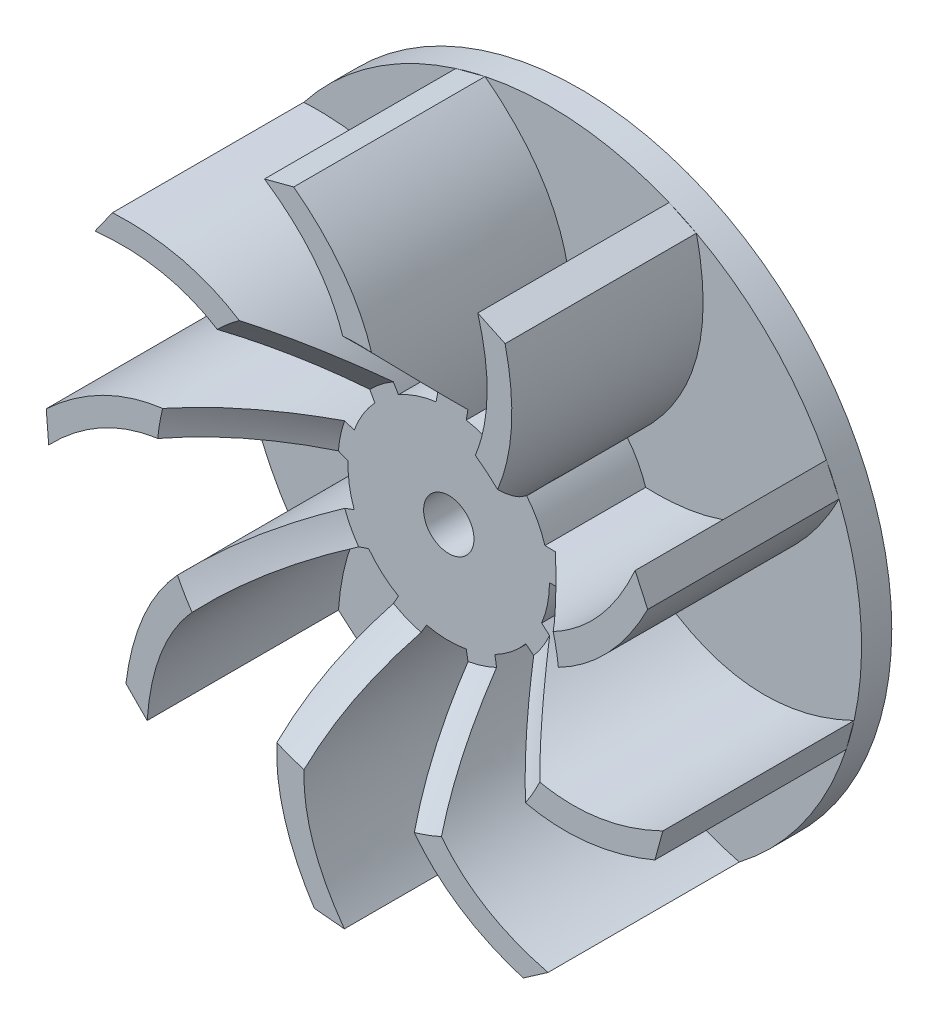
SolidWorks part; units mm, degrees
ref_plane "Спереди" through (0, 0, 0) normal (0, 0, 1) x (1, 0, 0)
ref_plane "Сверху" through (0, 0, 0) normal (0, 1, 0) x (1, 0, 0)
ref_plane "Справа" through (0, 0, 0) normal (1, 0, 0) x (0, 0, -1)
sketch "Эскиз1" plane through (0, 0, 0) normal (0, 0, 1) x (1, 0, 0)
  circle A0 centre (0, 0) radius 31
  dimension "D1" = 62
extrude "Бобышка-Вытянуть1" add sketch "Эскиз1" along normal blind 3
sketch "Эскиз2" plane through (0, 0, 3) normal (0, 0, 1) x (1, 0, 0)
  circle A0 centre (0, 0) radius 10
  dimension "D1" = 20
extrude "Бобышка-Вытянуть2" add sketch "Эскиз2" along normal blind 19
sketch "Эскиз3" plane through (0, 0, 22) normal (0, 0, 1) x (1, 0, 0)
  circle A0 centre (0, 0) radius 6
  dimension "D1" = 12
extrude "Вырез-Вытянуть1" cut sketch "Эскиз3" against normal through all
sketch "Эскиз4" plane through (0, 0, 3) normal (0, 0, 1) x (1, 0, 0)
  line L0 (-1000, 0) -> (49000, 0) construction
  line L1 (28.7592, 11.5718) -> (27.506, 14.2975)
  line L2 (10, 0) -> (9.55, 2.9661)
  line L3 (29.469, -9.6216) -> (30.2611, -6.728)
  line L4 (7.6604, -6.4279) -> (9.2223, -3.8665)
  line L5 (16.39, -26.3129) -> (18.8566, -24.6054)
  line L6 (1.7365, -9.8481) -> (4.5793, -8.8899)
  line L7 (-4.3582, -30.6921) -> (-1.371, -30.9697)
  line L8 (-5, -8.6603) -> (-2.2063, -9.7536)
  line L9 (-23.0671, -20.7101) -> (-20.9572, -22.8429)
  line L10 (-9.3969, -3.4202) -> (-7.9596, -6.0535)
  line L11 (-30.9826, -1.0377) -> (-30.7372, -4.0276)
  line L12 (-9.3969, 3.4202) -> (-9.9885, 0.4791)
  line L13 (-24.4011, 19.1204) -> (-26.135, 16.6722)
  line L14 (-5, 8.6603) -> (-7.3437, 6.7875)
  line L15 (-6.402, 30.3317) -> (-9.3039, 29.5709)
  line L16 (1.7365, 9.8481) -> (-1.2627, 9.92)
  line L17 (14.5927, 27.3506) -> (11.8806, 28.633)
  line L18 (7.6604, 6.4279) -> (5.4092, 8.4108)
  circle A0 centre (0, 0) radius 10 construction
  circle A1 centre (0, 0) radius 31 construction
  spline S0 degree 2 poles (10, 0) (22.751, -0.1391) (28.7592, 11.5718) knots 0 0 0 1 1 1
  spline S1 degree 2 poles (9.55, 2.9661) (22.2552, 2.515) (27.506, 14.2975) knots 0 0 0 1 1 1
  spline S2 degree 2 poles (7.6604, -6.4279) (17.3389, -14.7307) (29.469, -9.6216) knots 0 0 0 1 1 1
  spline S3 degree 2 poles (9.2223, -3.8665) (18.6651, -12.3787) (30.2611, -6.728) knots 0 0 0 1 1 1
  spline S4 degree 2 poles (1.7365, -9.8481) (3.8136, -22.4296) (16.39, -26.3129) knots 0 0 0 1 1 1
  spline S5 degree 2 poles (4.5793, -8.8899) (6.3414, -21.4803) (18.8566, -24.6054) knots 0 0 0 1 1 1
  spline S6 degree 2 poles (-5, -8.6603) (-11.496, -19.6334) (-4.3582, -30.6921) knots 0 0 0 1 1 1
  spline S7 degree 2 poles (-2.2063, -9.7536) (-8.9495, -20.5311) (-1.371, -30.9697) knots 0 0 0 1 1 1
  spline S8 degree 2 poles (-9.3969, -3.4202) (-21.4266, -7.6506) (-23.0671, -20.7101) knots 0 0 0 1 1 1
  spline S9 degree 2 poles (-7.9596, -6.0535) (-20.0528, -9.9751) (-20.9572, -22.8429) knots 0 0 0 1 1 1
  spline S10 degree 2 poles (-9.3969, 3.4202) (-21.3314, 7.9121) (-30.9826, -1.0377) knots 0 0 0 1 1 1
  spline S11 degree 2 poles (-9.9885, 0.4791) (-21.7732, 5.2484) (-30.7372, -4.0276) knots 0 0 0 1 1 1
  spline S12 degree 2 poles (-5, 8.6603) (-11.255, 19.7725) (-24.4011, 19.1204) knots 0 0 0 1 1 1
  spline S13 degree 2 poles (-7.3437, 6.7875) (-13.3057, 18.016) (-26.135, 16.6722) knots 0 0 0 1 1 1
  spline S14 degree 2 poles (1.7365, 9.8481) (4.0877, 22.3812) (-6.402, 30.3317) knots 0 0 0 1 1 1
  spline S15 degree 2 poles (-1.2627, 9.92) (1.3877, 22.3538) (-9.3039, 29.5709) knots 0 0 0 1 1 1
  spline S16 degree 2 poles (7.6604, 6.4279) (17.5177, 14.5175) (14.5927, 27.3506) knots 0 0 0 1 1 1
  spline S17 degree 2 poles (5.4092, 8.4108) (15.4318, 16.232) (11.8806, 28.633) knots 0 0 0 1 1 1
  point P64 (0, 0)
  dimension "D1" = 3
  dimension "D2" = 3
  dimension "D3" = 9
extrude "Бобышка-Вытянуть5" add sketch "Эскиз4" along normal blind 19
sketch "Эскиз5" plane through (0, 0, 22) normal (0, 0, 1) x (1, 0, 0)
  circle A0 centre (0, 0) radius 20
  dimension "D1" = 40
extrude "Вырез-Вытянуть2" cut sketch "Эскиз5" against normal blind 9 draft 45
sketch "Эскиз6" plane through (0, 0, 0) normal (0, 0, -1) x (-1, 0, 0)
  circle A0 centre (0, 0) radius 6.5
  dimension "D1" = 13
extrude "Бобышка-Вытянуть6" add sketch "Эскиз6" against normal blind 13
sketch "Эскиз7" plane through (0, 0, 0) normal (0, 0, -1) x (-1, 0, 0)
  circle A0 centre (0, 0) radius 5
  dimension "D1" = 10
extrude "Вырез-Вытянуть3" cut sketch "Эскиз7" against normal blind 5
sketch "Эскиз8" plane through (0, 0, 0) normal (0, 0, -1) x (-1, 0, 0)
  circle A0 centre (0, 0) radius 2.5
  dimension "D1" = 5
extrude "Вырез-Вытянуть4" cut sketch "Эскиз8" against normal through all
